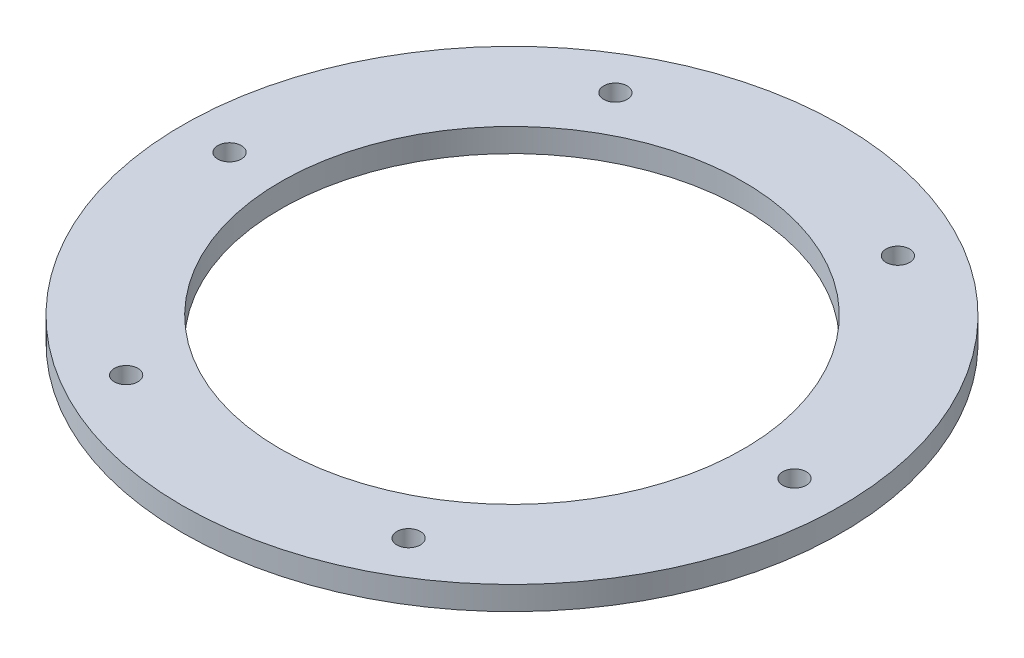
SolidWorks part; units mm, degrees
ref_plane "Front" through (0, 0, 0) normal (0, 0, 1) x (1, 0, 0)
ref_plane "Top" through (0, 0, 0) normal (0, 1, 0) x (1, 0, 0)
ref_plane "Right" through (0, 0, 0) normal (1, 0, 0) x (0, 0, -1)
sketch "Sketch1" plane through (0, 0, 0) normal (0, 1, 0) x (1, 0, 0)
  circle A0 centre (0, 0) radius 29.5
  circle A1 centre (0, 0) radius 42
  dimension "D1" = 59
  dimension "D2" = 84
extrude "Boss-Extrude1" add sketch "Sketch1" along normal blind 3
sketch "Sketch2" plane through (0, 3, 0) normal (0, 1, 0) x (1, 0, 0)
  line L0 (0, 0) -> (36, 0) construction
  circle A0 centre (36, 0) radius 1.5
  dimension "D1" = 3
  dimension "D2" = 36
extrude "bolt hole" cut sketch "Sketch2" against normal up to next
pattern_circular "bolt pattern" count 6 over 360 about axis through (0, 0, 0) along (0, 1, 0) of "bolt hole"
